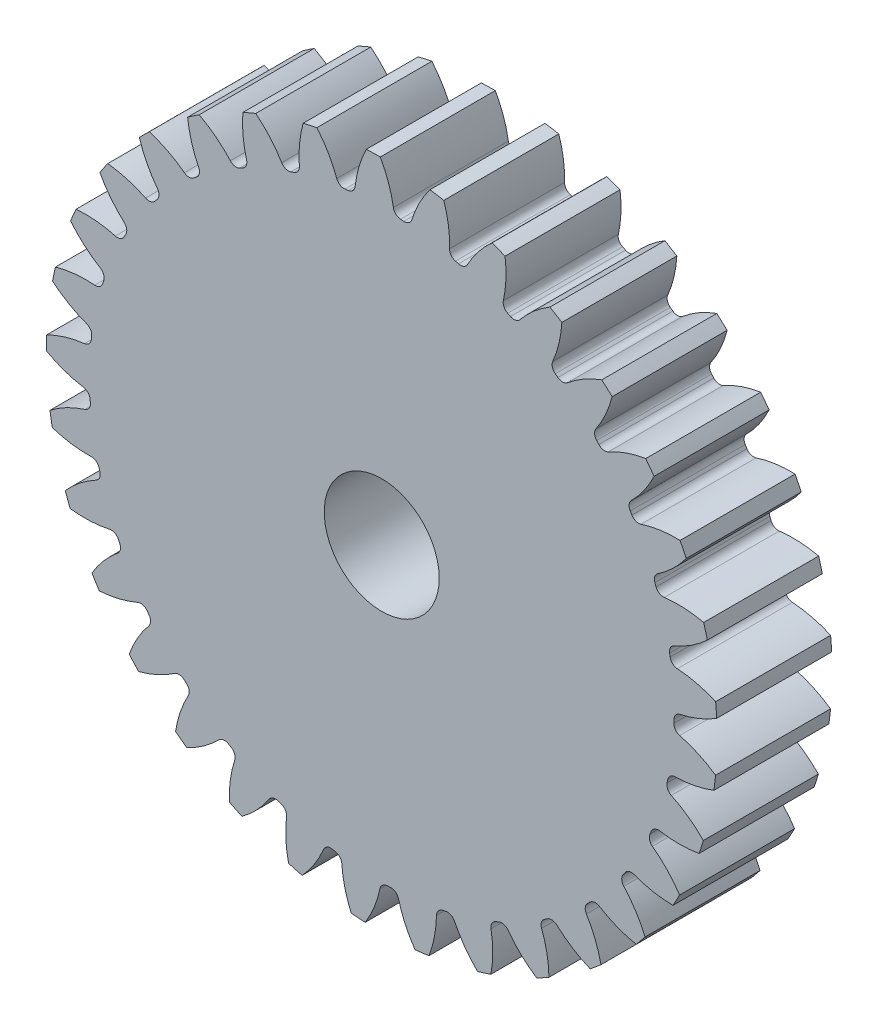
SolidWorks part; units mm, degrees
ref_plane "Front" through (0, 0, 0) normal (0, 0, 1) x (1, 0, 0)
ref_plane "Top" through (0, 0, 0) normal (0, 1, 0) x (1, 0, 0)
ref_plane "Right" through (0, 0, 0) normal (1, 0, 0) x (0, 0, -1)
sketch "Sketch3" plane through (0, 0, 0) normal (0, 0, 1) x (1, 0, 0)
  circle A0 centre (0, 0) radius 296.3333
  dimension "od" = 592.6667
extrude "gearBody" add sketch "Sketch3" along normal blind 101.6
sketch "Sketch2" plane through (0, 0, 0) normal (0, 0, 1) x (1, 0, 0)
  line L0 (0, 0) -> (242.5647, 100.4736) construction
  line L1 (295.3332, -28.9065) -> (0, 0) construction
  line L2 (0, 0) -> (36.3143, 0) construction
  line L3 (279.3129, 6.9767) -> (278.7178, -19.5129) construction
  line L5 (279.0153, -6.2681) -> (0, 0) construction
  line L7 (0, 0) -> (262.5501, 0) construction
  arc A0 (262.5423, 2.0206) -> (262.1867, -13.8087) centre (0, 0) ccw construction
  arc A1 (295.9348, 15.3635) -> (294.9463, -28.6377) centre (0, 0) ccw construction
  arc A2 (279.3129, 6.9767) -> (278.7178, -19.5129) centre (0, 0) ccw construction
  arc A3 (258.1322, -7.2275) -> (258.1963, -4.3718) centre (0, 0) ccw
  arc A4 (295.3332, -28.9065) -> (263.2743, -14.0872) centre (237.808, -111.2652) ccw
  arc A5 (295.3332, -28.9065) -> (296.3333, 15.6147) centre (0, 0) ccw
  arc A6 (296.3333, 15.6147) -> (263.6413, 2.25) centre (242.5647, 100.4736) cw
  arc A7 (258.1963, -4.3718) -> (263.6413, 2.25) centre (265.0872, -4.4885) cw
  arc A8 (263.2743, -14.0872) -> (258.1322, -7.2275) centre (265.0213, -7.4204) cw
  point P6 (296.3333, 15.6147)
  point P22 (295.3332, -28.9065)
  dimension "baseDia" = 525.1002
  dimension "od" = 592.6667
  dimension "pd" = 558.8
  dimension "rd" = 516.4667
  dimension "rFillet" = 6.8919
  dimension "pointX" = 296.3333
  dimension "pointY" = 15.6147
  dimension "CTT" = 26.4896
  dimension "flankCenterAngle" = 22.5
extrude "toothCut" cut sketch "Sketch2" along normal through all
pattern_circular "CirPattern1" count 33 over 360 about axis through (0, 0, 0) along (0, 0, 1) of "toothCut"
sketch "hub1Dia" plane through (0, 0, 0) normal (0, 0, -1) x (-1, 0, 0)
  circle A0 centre (0, 0) radius 12.7
  dimension "hub1Dia" = 25.4
sketch "hub2Dia" plane through (0, 0, 101.6) normal (0, 0, 1) x (1, 0, 0)
  circle A0 centre (0, 0) radius 12.7
  dimension "hub2dia" = 25.4
sketch "boreDia" plane through (0, 0, 0) normal (0, 0, 1) x (1, 0, 0)
  circle A0 centre (0, 0) radius 50.8
  dimension "boreDia" = 101.6
extrude "bore" cut sketch "boreDia" against normal mid plane 25400
